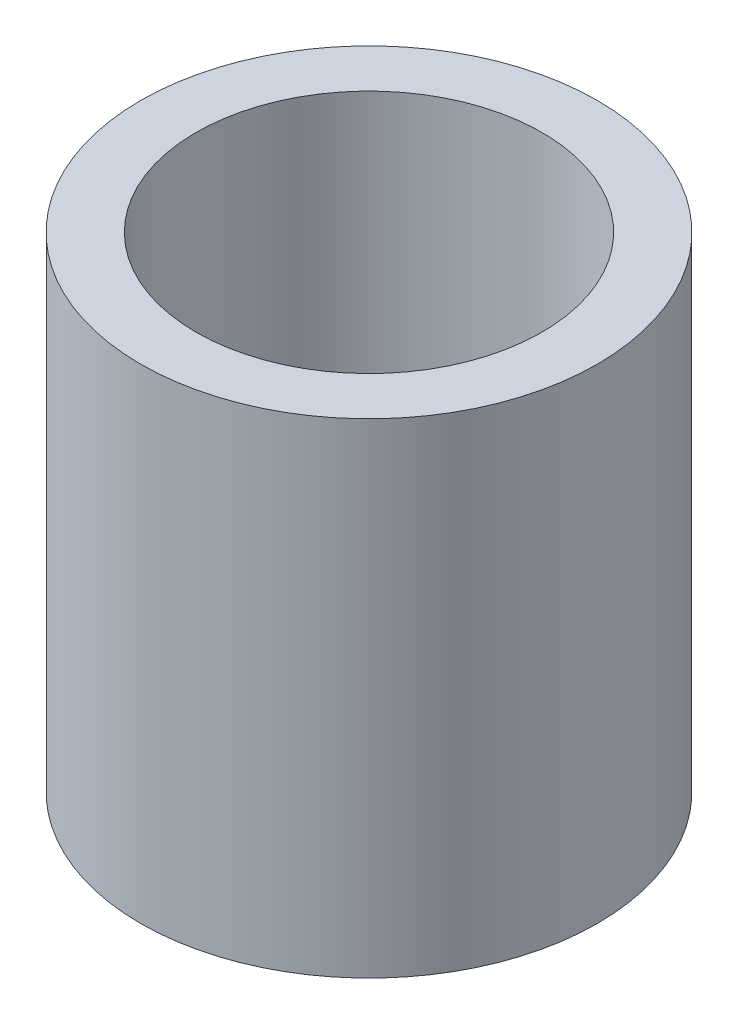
SolidWorks part; units mm, degrees
ref_plane "Front" through (0, 0, 0) normal (0, 0, 1) x (1, 0, 0)
ref_plane "Top" through (0, 0, 0) normal (0, 1, 0) x (1, 0, 0)
ref_plane "Right" through (0, 0, 0) normal (1, 0, 0) x (0, 0, -1)
sketch "Sketch1" plane through (0, 0, 0) normal (0, 1, 0) x (1, 0, 0)
  circle A0 centre (0, 0) radius 33
  circle A1 centre (0, 0) radius 25
  dimension "D1" = 50
  dimension "D2" = 66
extrude "Base-Extrude" add sketch "Sketch1" along normal blind 70
